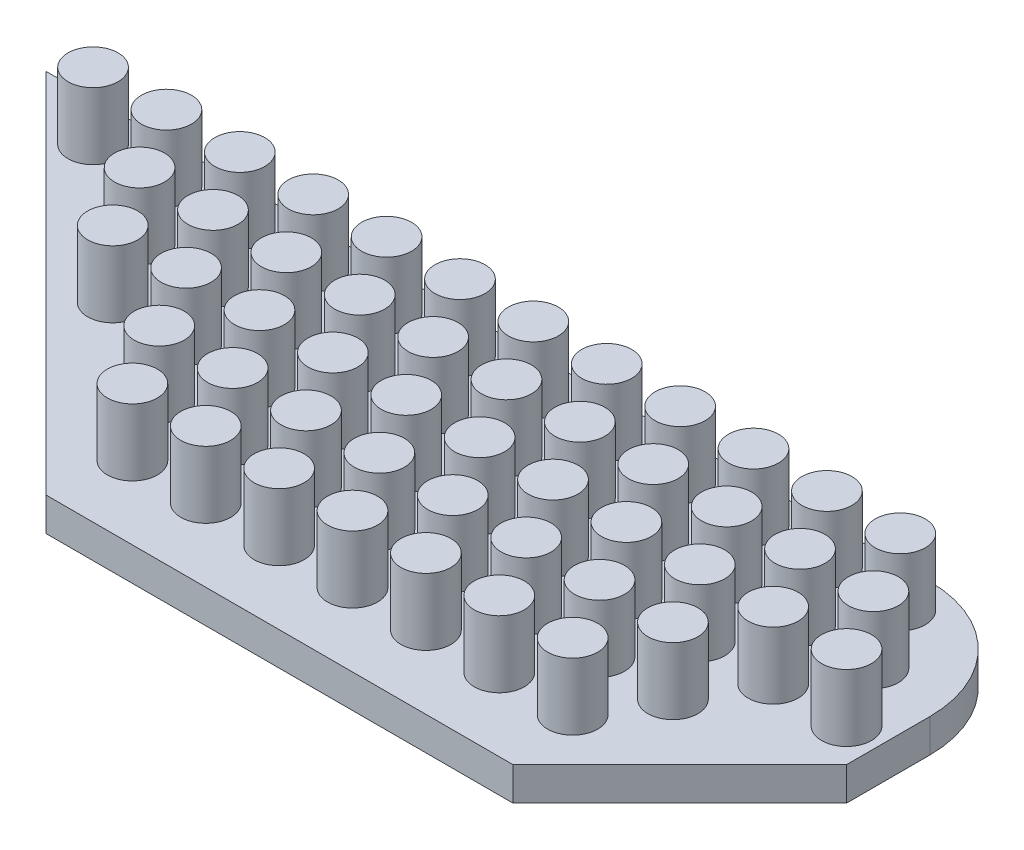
SolidWorks part; units mm, degrees
ref_plane "Front Plane" through (0, 0, 0) normal (0, 0, 1) x (1, 0, 0)
ref_plane "Top Plane" through (0, 0, 0) normal (0, 1, 0) x (1, 0, 0)
ref_plane "Right Plane" through (0, 0, 0) normal (1, 0, 0) x (0, 0, -1)
sketch "Sketch1" plane through (0, 0, 0) normal (0, 1, 0) x (1, 0, 0)
  line L0 (0, 0) -> (140, 0)
  line L1 (140, 0) -> (190, 50)
  line L2 (190, 50) -> (190, 75)
  line L3 (155, 110) -> (-110, 110)
  line L4 (-110, 110) -> (0, 0)
  arc A0 (190, 75) -> (155, 110) centre (155, 75) ccw
  dimension "D4" = 35
  dimension "D1" = 135
  dimension "D2" = 50
  dimension "D3" = 140
  dimension "D5" = 135
  dimension "D6" = 300
extrude "Extrude1" add sketch "Sketch1" along normal blind 10
sketch "Sketch3" plane through (0, 10, 0) normal (0, 1, 0) x (-1, 0, 0)
  line L0 (-155, -110) -> (110, -110) construction
  line L1 (-190, -50) -> (-190, -75) construction
  circle A0 centre (-70, -60) radius 7.5
  dimension "D1" = 15
  dimension "D2" = 50
  dimension "D3" = 120
extrude "Extrude2" add sketch "Sketch3" along normal blind 20
other "Fill Pattern1" parameters "D1"=22, "D2"=60, "D3"=2
